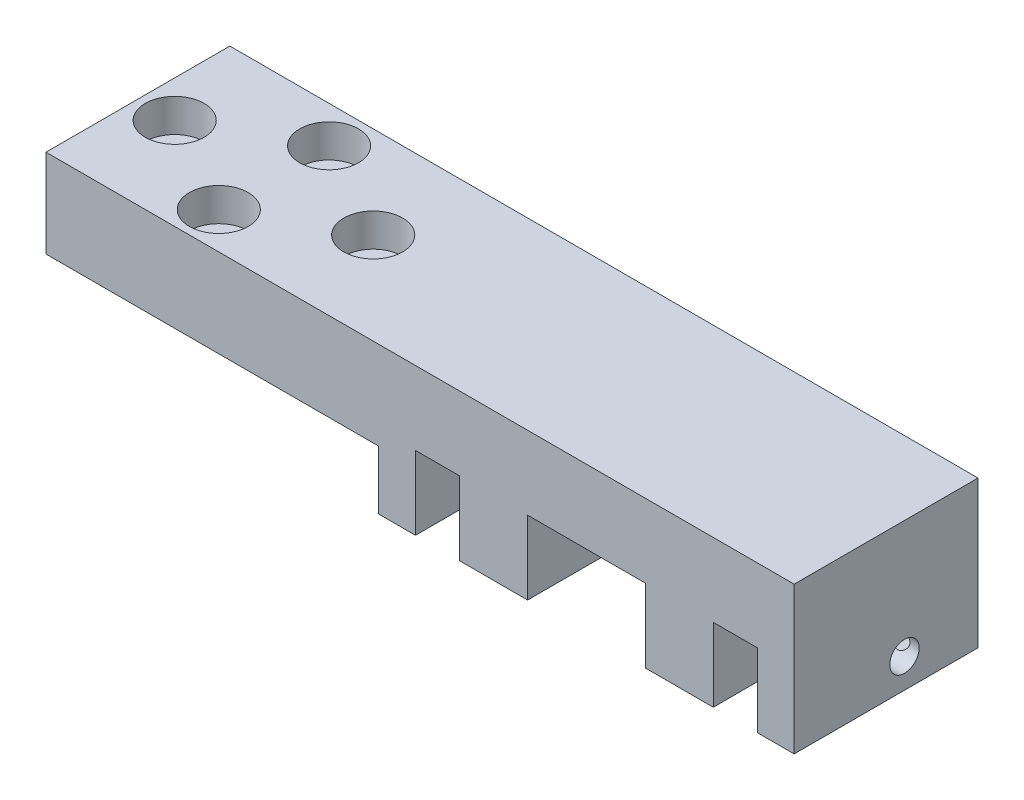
SolidWorks part; units mm, degrees
ref_plane "前视基准面" through (0, 0, 0) normal (0, 0, 1) x (1, 0, 0)
ref_plane "上视基准面" through (0, 0, 0) normal (0, 1, 0) x (1, 0, 0)
ref_plane "右视基准面" through (0, 0, 0) normal (1, 0, 0) x (0, 0, -1)
sketch "草图1" plane through (0, 0, 0) normal (0, 0, 1) x (1, 0, 0)
  line L0 (90.75, 0) -> (90.75, 10)
  line L1 (96.75, 0) -> (96.75, 10)
  line L2 (50.25, 0) -> (50.25, 10)
  line L3 (56.25, 0) -> (56.25, 10)
  line L4 (0, 20) -> (101.75, 20)
  line L5 (50.25, 10) -> (56.25, 10)
  line L6 (45.25, 0) -> (50.25, 0)
  line L7 (45.25, 0) -> (45.25, 8)
  line L8 (101.75, 0) -> (101.75, 20)
  line L9 (56.25, 0) -> (65.5, 0)
  line L10 (96.75, 0) -> (101.75, 0)
  line L11 (90.75, 10) -> (96.75, 10)
  line L12 (65.5, 0) -> (65.5, 10)
  line L13 (81.5, 0) -> (81.5, 10)
  line L14 (81.5, 10) -> (65.5, 10)
  line L15 (81.5, 0) -> (90.75, 0)
  line L16 (0, 20) -> (0, 8)
  line L17 (0, 8) -> (45.25, 8)
extrude "凸台-拉伸1" add sketch "草图1" along normal blind 25
sketch "草图2" plane through (101.75, 0, 0) normal (1, 0, 0) x (0, 0, -1)
  circle A0 centre (-10, 4) radius 2
extrude "切除-拉伸1" cut sketch "草图2" against normal through all
sketch "草图3" plane through (0, 0, 25) normal (0, 0, 1) x (1, 0, 0)
  circle A0 centre (61.25, 4) radius 1.25 construction
  circle A1 centre (85.75, 4) radius 1.25 construction
  circle A2 centre (99.25, 4) radius 1.25 construction
  circle A3 centre (47.75, 4) radius 1.25 construction
sketch "草图4" plane through (0, 0, 0) normal (0, 0, -1) x (-1, 0, 0)
  circle A0 centre (-99.25, 4) radius 1.25
  circle A1 centre (-85.75, 4) radius 1.25
  circle A2 centre (-61.25, 4) radius 1.25
  circle A3 centre (-47.75, 4) radius 1.25
extrude "切除-拉伸2" cut sketch "草图4" against normal blind 10
sketch "草图5" plane through (0, 20, 0) normal (0, 1, 0) x (1, 0, 0)
  circle A0 centre (18.5, -5) radius 2.25
  circle A1 centre (18.5, -20) radius 2.25
  circle A2 centre (5, -12.5) radius 2.25
  circle A3 centre (32, -12.5) radius 2.25
extrude "切除-拉伸3" cut sketch "草图5" against normal through all
sketch "草图6" plane through (0, 20, 0) normal (0, 1, 0) x (1, 0, 0)
  circle A0 centre (18.5, -5) radius 4
  circle A1 centre (18.5, -20) radius 4
  circle A2 centre (5, -12.5) radius 4
  circle A3 centre (32, -12.5) radius 4
extrude "切除-拉伸4" cut sketch "草图6" against normal blind 4.5
sketch "草图7" plane through (0, 20, 0) normal (0, 1, 0) x (1, 0, 0)
  circle A0 centre (53.25, -20) radius 1.75 construction
  circle A1 centre (93.75, -20) radius 1.75 construction
sketch "草图8" plane through (0, 10, 0) normal (0, -1, 0) x (1, 0, 0)
  circle A0 centre (53.25, 20) radius 1.75
  circle A1 centre (93.75, 20) radius 1.75
extrude "切除-拉伸5" cut sketch "草图8" against normal blind 3.5
